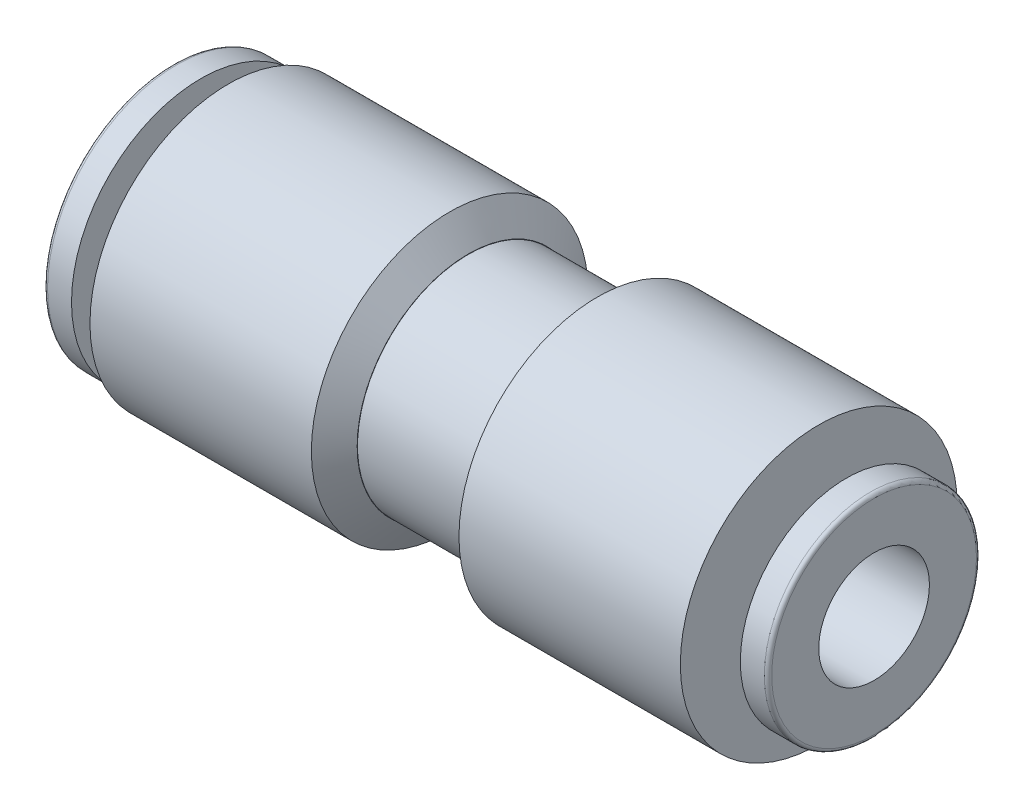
SolidWorks part; units mm, degrees
ref_plane "Front Plane" through (0, 0, 0) normal (0, 0, 1) x (1, 0, 0)
ref_plane "Top Plane" through (0, 0, 0) normal (0, 1, 0) x (1, 0, 0)
ref_plane "Right Plane" through (0, 0, 0) normal (1, 0, 0) x (0, 0, -1)
sketch "Sketch1" plane through (0, 0, 0) normal (1, 0, 0) x (0, 0, -1)
  circle A0 centre (0, 0) radius 7.5
extrude "Boss-Extrude1" add sketch "Sketch1" along normal blind 13
sketch "Sketch2" plane through (13, 0, 0) normal (1, 0, 0) x (0, 0, -1)
  circle A0 centre (0, 0) radius 6
extrude "Boss-Extrude2" add sketch "Sketch2" along normal blind 6
sketch "Sketch3" plane through (19, 0, 0) normal (1, 0, 0) x (0, 0, -1)
  circle A0 centre (0, 0) radius 7.5
extrude "Boss-Extrude3" add sketch "Sketch3" along normal blind 13
sketch "Sketch4" plane through (32, 0, 0) normal (1, 0, 0) x (0, 0, -1)
  circle A0 centre (0, 0) radius 3.5
extrude "Boss-Extrude4" add sketch "Sketch4" along normal blind 1.5
sketch "Sketch5" plane through (33.5, 0, 0) normal (1, 0, 0) x (0, 0, -1)
  circle A0 centre (0, 0) radius 5.75
extrude "Boss-Extrude5" add sketch "Sketch5" along normal blind 1.5
sketch "Sketch6" plane through (0, 0, 0) normal (-1, 0, 0) x (0, 0, 1)
  circle A0 centre (0, 0) radius 4.5
extrude "Boss-Extrude6" add sketch "Sketch6" along normal blind 1.5
sketch "Sketch7" plane through (-1.5, 0, 0) normal (-1, 0, 0) x (0, 0, 1)
  circle A0 centre (0, 0) radius 7
extrude "Boss-Extrude7" add sketch "Sketch7" along normal blind 1.5
sketch "Sketch8" plane through (35, 0, 0) normal (1, 0, 0) x (0, 0, -1)
  circle A0 centre (0, 0) radius 3
extrude "Cut-Extrude1" cut sketch "Sketch8" against normal blind 19
sketch "Sketch9" plane through (-3, 0, 0) normal (-1, 0, 0) x (0, 0, 1)
  circle A0 centre (0, 0) radius 4
extrude "Cut-Extrude2" cut sketch "Sketch9" against normal blind 19
chamfer "Chamfer2" distance 1 angle 56 1 edges at (13, 0, -7.5)
chamfer "Chamfer4" distance 1 angle 56 1 edges at (19, 0, -7.5)
fillet "Fillet1" radius 0.2 2 edges at (35, 0, -5.75) (-3, 0, 7)
